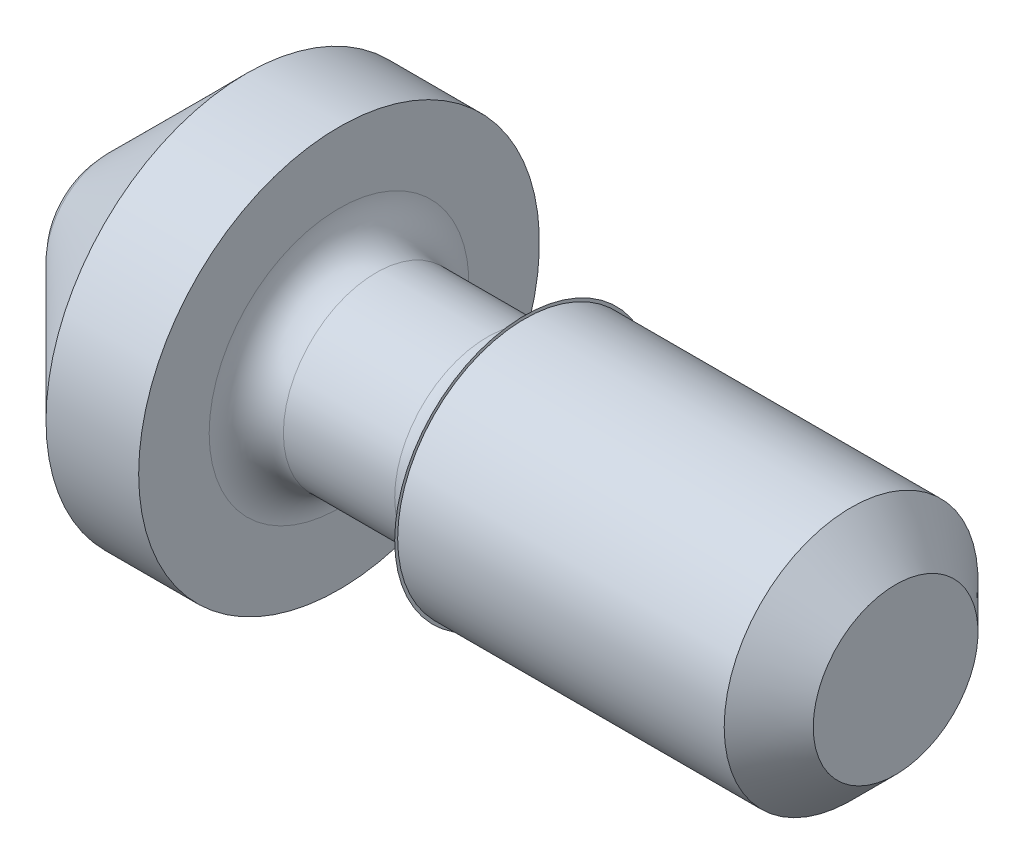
SolidWorks part; units mm, degrees
ref_plane "Front Plane" through (0, 0, 0) normal (0, 0, 1) x (1, 0, 0)
ref_plane "Top Plane" through (0, 0, 0) normal (0, 1, 0) x (1, 0, 0)
ref_plane "Right Plane" through (0, 0, 0) normal (1, 0, 0) x (0, 0, -1)
sketch "Sketch2" plane through (0, 0, 0) normal (0, 0, 1) x (1, 0, 0)
  line L0 (-0.762, 0) -> (-6.35, 0)
  line L1 (-6.985, -0.5842) -> (-8.89, -0.5842)
  line L2 (-6.35, 0) -> (-6.35, 0.0508)
  line L3 (0, -0.762) -> (-0.762, 0)
  line L4 (-9.525, 0.0508) -> (-9.525, 1.2573)
  line L5 (-9.525, 1.2573) -> (-11.1106, 1.2573)
  line L6 (-46.6279, -2.1717) -> (49953.3721, -2.1717) construction
  line L7 (0, -0.762) -> (0, -2.1717)
  line L8 (-11.1106, 1.2573) -> (-13.462, -1.0941)
  line L9 (-13.9084, -2.1717) -> (0, -2.1717)
  arc A0 (-9.525, 0.0508) -> (-8.89, -0.5842) centre (-8.89, 0.0508) ccw
  arc A1 (-6.35, 0.0508) -> (-6.985, -0.5842) centre (-6.985, 0.0508) cw
  arc A2 (-13.462, -1.0941) -> (-13.9084, -2.1717) centre (-12.3844, -2.1717) ccw
  point P0 (0, 0)
  dimension "D1" = 0.635
  dimension "D8" = 1.524
  dimension "D2" = 6.35
  dimension "D3" = 9.525
  dimension "D4" = 2.1717
  dimension "D5" = 1.5875
  dimension "D6" = 3.429
  dimension "D7" = 13.462
  dimension "D9" = 0.762
  dimension "D10" = 45
  dimension "D11" = 45
revolve "Revolve1" add sketch "Sketch2" angle 360 about L6
